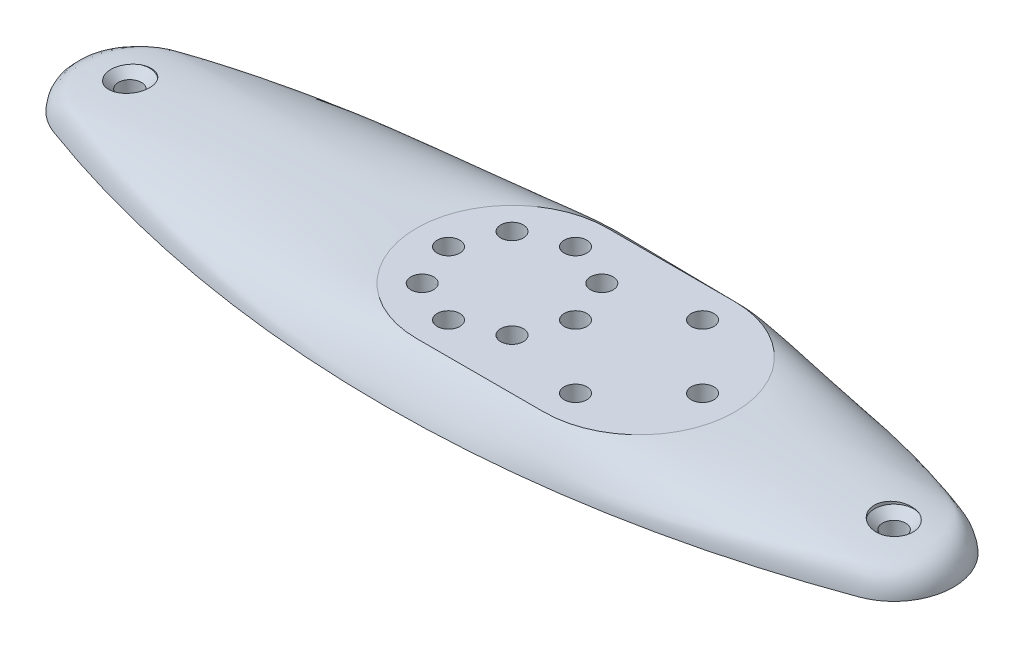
SolidWorks part; units mm, degrees
ref_plane "Front Plane" through (0, 0, 0) normal (0, 0, 1) x (1, 0, 0)
ref_plane "Top Plane" through (0, 0, 0) normal (0, 1, 0) x (1, 0, 0)
ref_plane "Right Plane" through (0, 0, 0) normal (1, 0, 0) x (0, 0, -1)
sketch "Sketch1" plane through (0, 0, 0) normal (0, 1, 0) x (1, 0, 0)
  line L0 (0, 19.05) -> (0, -19.05) construction
  line L1 (-66.04, 0) -> (66.04, 0) construction
  line L2 (19.05, 18.0083) -> (19.05, -18.0083) construction
  arc A0 (-60.214, 8.3453) -> (-60.214, -8.3453) centre (-57.15, 0) ccw
  arc A1 (60.214, 8.3453) -> (60.214, -8.3453) centre (57.15, 0) cw
  arc A2 (-60.214, 8.3453) -> (60.214, 8.3453) centre (0, -155.6544) cw
  arc A3 (-60.214, -8.3453) -> (60.214, -8.3453) centre (0, 155.6544) ccw
  point P8 (0, 19.05)
  dimension "D1" = 8.89
  dimension "D2" = 38.1
  dimension "D3" = 114.3
  dimension "D4" = 19.05
ref_plane "Plane1" through (0, 6.35, 0) normal (0, 1, 0) x (1, 0, 0)
sketch "Sketch2" plane through (0, 6.35, 0) normal (0, 1, 0) x (1, 0, 0)
  line L0 (0, 14.2875) -> (0, -14.2875) construction
  line L1 (-14.2875, 0) -> (33.3375, 0) construction
  line L2 (0, 14.2875) -> (19.05, 14.2875)
  line L3 (19.05, -14.2875) -> (0, -14.2875)
  arc A0 (0, 14.2875) -> (0, -14.2875) centre (0, 0) ccw
  arc A1 (19.05, 14.2875) -> (19.05, -14.2875) centre (19.05, 0) cw
  dimension "D1" = 28.575
  dimension "D2" = 19.05
sketch "Sketch3" plane through (0, 0, 0) normal (1, 0, 0) x (0, 0, -1)
  line L0 (17.4927, 6.35) -> (-17.4927, 6.35) construction
  line L1 (14.2875, 6.35) -> (-14.2875, 6.35) construction
  line L2 (19.05, 0) -> (-19.05, 0) construction
  arc A0 (-19.05, 0) -> (-14.2875, 6.35) centre (-7.0176, -4.0634) cw
  arc A1 (14.2875, 6.35) -> (19.05, 0) centre (7.0176, -4.0634) cw
  dimension "D1" = 12.7
sketch "Sketch4" plane through (0, 0, 0) normal (0, 0, 1) x (1, 0, 0)
  line L3 (-60.214, 0) -> (-66.04, 0) construction
  line L4 (-66.04, 0) -> (-66.04, -2.54) construction
  line L5 (-66.04, -2.54) -> (66.04, -2.54) construction
  line L6 (66.04, -2.54) -> (66.04, 0) construction
  line L7 (-66.04, 0) -> (66.04, 0) construction
  line L8 (60.214, 0) -> (-60.214, 0) construction
  arc A0 (-62.5937, 3.81) -> (-14.2875, 6.35) centre (-11.7964, -501.6439) cw
  arc A1 (33.3375, 6.35) -> (62.6461, 3.81) centre (4.1494, -500.8108) cw
  arc A2 (-62.5937, 3.81) -> (-66.04, 0) centre (-62.2108, 0) ccw
  arc A3 (62.6461, 3.81) -> (66.04, 0) centre (62.2045, 0) cw
  dimension "D1" = 508
  dimension "D2" = 3.81
  dimension "D3" = 3.81
  dimension "D4" = 2.54
ref_plane "Plane2" through (19.05, 0, 0) normal (1, 0, 0) x (0, 0, -1)
sketch "Sketch8" plane through (19.05, 0, 0) normal (1, 0, 0) x (0, 0, -1)
  arc A0 (14.2875, 6.35) -> (18.0083, 0) centre (5.6605, -2.9701) cw
  arc A1 (-14.2875, 6.35) -> (-18.0083, 0) centre (-5.6605, -2.9701) ccw
  arc A2 (19.05, 0) -> (14.2875, 6.35) centre (7.0176, -4.0634) ccw construction
loft "Loft1" add profiles "Sketch2", "Sketch1"
sketch "Sketch5" plane through (0, 0, 0) normal (0, -1, 0) x (-1, 0, 0)
  line L0 (-9.5, 0) -> (0, 0) construction
  line L1 (0, 0) -> (0, 9.5) construction
  line L2 (0, 0) -> (9.5, 0) construction
  line L3 (0, 0) -> (0, -9.5) construction
  line L4 (-9.5, 0) -> (-19, 0) construction
  line L5 (66.04, 0) -> (-66.04, 0) construction
  line L6 (-19, 0) -> (-19, -9.5) construction
  line L7 (-19, 0) -> (-28.5, 0) construction
  line L8 (-19, 0) -> (-19, 9.5) construction
  line L9 (6.7175, -6.7175) -> (0, 0) construction
  line L10 (0, 0) -> (6.7175, 6.7175) construction
  line L11 (-6.7175, 6.7175) -> (0, 0) construction
  line L12 (0, 0) -> (-6.7175, -6.7175) construction
  circle A0 centre (-9.5, 0) radius 1.75
  circle A1 centre (0, 9.5) radius 1.75
  circle A2 centre (9.5, 0) radius 1.75
  circle A3 centre (0, -9.5) radius 1.75
  circle A4 centre (-57.15, 0) radius 1.75
  circle A5 centre (57.15, 0) radius 1.75
  circle A6 centre (-28.5, 0) radius 1.75
  circle A7 centre (-19, 9.5) radius 1.75
  circle A8 centre (-19, -9.5) radius 1.75
  circle A9 centre (6.7175, 6.7175) radius 1.75
  circle A10 centre (-6.7175, 6.7175) radius 1.75
  circle A11 centre (-6.7175, -6.7175) radius 1.75
  circle A12 centre (6.7175, -6.7175) radius 1.75
  dimension "D2" = 3.5
  dimension "D5" = 3.5
  dimension "D6" = 45
  dimension "D1" = 19
  dimension "D3" = 57.15
  dimension "D4" = 57.15
extrude "Cut-Extrude1" cut sketch "Sketch5" against normal through all
ref_plane "Plane3" through (58.9, 0, 0) normal (-1, 0, 0) x (0, 0, 1)
ref_plane "Plane5" through (-58.9, 0, 0) normal (1, 0, 0) x (0, 0, -1)
sketch "Sketch16" plane through (58.9, 0, 0) normal (-1, 0, 0) x (0, 0, 1)
  line L0 (0, 4.2303) -> (-2, 4.2303)
  line L1 (0, 4.2303) -> (0, 0) construction
  spline S0 degree 3 poles (-1.75, 4.3985) (-1.75, 4.3742) (-1.7387, 4.3626) (-1.6939, 4.3403) (-1.6602, 4.3297) (-1.5293, 4.3004) (-1.3988, 4.2835) (-1.1566, 4.2635) (-1.0668, 4.2576) (-0.8756, 4.2476) (-0.7748, 4.2435) (-0.563, 4.2369) (-0.4511, 4.2344) (-0.2265, 4.2311) (-0.1127, 4.2303) (0.2335, 4.2303) (0.4614, 4.2336) (0.7809, 4.2437) (0.8815, 4.2479) (1.0713, 4.2579) (1.1612, 4.2638) (1.3226, 4.2773) (1.3947, 4.2847) (1.5214, 4.3014) (1.5758, 4.3107) (1.7055, 4.3401) (1.7505, 4.3628) (1.7495, 4.4107) (1.7036, 4.4363) (1.5726, 4.4734) (1.5178, 4.4857) (1.391, 4.5089) (1.3188, 4.5199) (1.0755, 4.5509) (0.8828, 4.568) (0.5626, 4.5857) (0.4532, 4.5901) (0.2288, 4.5962) (0.1126, 4.5977) (-0.117, 4.5977) (-0.2307, 4.5961) (-0.4559, 4.59) (-0.5674, 4.5854) (-0.8836, 4.5678) (-1.0787, 4.5505) (-1.4001, 4.5095) (-1.5299, 4.4855) (-1.6605, 4.4485) (-1.6942, 4.4357) (-1.7387, 4.4108) (-1.75, 4.3985) (-1.75, 4.3742) (-1.7387, 4.3626) knots -0.03125 -0.03125 0 0 0.03125 0.03125 0.0625 0.0625 0.125 0.125 0.15625 0.15625 0.1875 0.1875 0.21875 0.21875 0.25 0.25 0.3125 0.3125 0.34375 0.34375 0.375 0.375 0.40625 0.40625 0.4375 0.4375 0.5 0.5 0.5625 0.5625 0.59375 0.59375 0.625 0.625 0.6875 0.6875 0.71875 0.71875 0.75 0.75 0.78125 0.78125 0.8125 0.8125 0.875 0.875 0.9375 0.9375 0.96875 0.96875 1 1 1.03125 1.03125 1.0625 only from (-1.75, 4.3863) to (-1.75, 4.3863) construction
  dimension "D1" = 2
sketch "Sketch18" plane through (-58.9, 0, 0) normal (1, 0, 0) x (0, 0, -1)
  line L0 (0, 4.1676) -> (-2, 4.1676)
  line L1 (0, 4.2303) -> (0, 0) construction
  spline S0 degree 3 poles (0.1158, 4.4815) (-0.1158, 4.4815) (-0.2302, 4.4802) (-0.4561, 4.4751) (-0.5672, 4.4713) (-0.8832, 4.4566) (-1.0784, 4.4421) (-1.3196, 4.4164) (-1.3931, 4.407) (-1.5201, 4.3873) (-1.5735, 4.3772) (-1.6607, 4.3563) (-1.6944, 4.3455) (-1.7387, 4.3244) (-1.75, 4.314) (-1.7501, 4.283) (-1.7053, 4.2638) (-1.5732, 4.2381) (-1.5195, 4.2302) (-1.3929, 4.2157) (-1.3191, 4.209) (-1.1572, 4.1972) (-1.0691, 4.1921) (-0.8785, 4.1832) (-0.7758, 4.1795) (-0.4592, 4.1706) (-0.2283, 4.1676) (0.1144, 4.1676) (0.23, 4.1684) (0.4556, 4.1713) (0.5648, 4.1736) (0.7763, 4.1795) (0.8792, 4.1832) (1.0692, 4.1921) (1.1574, 4.1972) (1.4011, 4.215) (1.5297, 4.2296) (1.6616, 4.2553) (1.6944, 4.2643) (1.7387, 4.2833) (1.7501, 4.2934) (1.7499, 4.314) (1.7387, 4.3244) (1.6943, 4.3456) (1.6606, 4.3563) (1.53, 4.3876) (1.3999, 4.4078) (1.0782, 4.4422) (0.8833, 4.4566) (0.5666, 4.4713) (0.455, 4.4751) (0.23, 4.4802) (0.1158, 4.4815) (-0.1158, 4.4815) (-0.2302, 4.4802) knots -0.03125 -0.03125 0 0 0.03125 0.03125 0.0625 0.0625 0.125 0.125 0.15625 0.15625 0.1875 0.1875 0.21875 0.21875 0.25 0.25 0.3125 0.3125 0.34375 0.34375 0.375 0.375 0.40625 0.40625 0.4375 0.4375 0.5 0.5 0.53125 0.53125 0.5625 0.5625 0.59375 0.59375 0.625 0.625 0.6875 0.6875 0.71875 0.71875 0.75 0.75 0.78125 0.78125 0.8125 0.8125 0.875 0.875 0.9375 0.9375 0.96875 0.96875 1 1 1.03125 1.03125 1.0625 only from (0, 4.4815) to (0, 4.4815) construction
  dimension "D1" = 2
ref_plane "Plane4" through (0, 4.2303, 0) normal (0, 1, 0) x (1, 0, 0)
ref_plane "Plane6" through (0, 4.1676, 0) normal (0, 1, 0) x (1, 0, 0)
sketch "Sketch17" plane through (0, 4.2303, 0) normal (0, 1, 0) x (1, 0, 0)
  circle A0 centre (57.15, 0) radius 2.95
  circle A1 centre (57.15, 0) radius 1.75 construction
  dimension "D1" = 1.2
extrude "Cut-Extrude7" cut sketch "Sketch17" along normal blind 3
sketch "Sketch19" plane through (0, 4.1676, 0) normal (0, 1, 0) x (1, 0, 0)
  circle A0 centre (-57.15, 0) radius 2.95
  circle A1 centre (-57.15, 0) radius 1.75 construction
  dimension "D1" = 1.2
extrude "Cut-Extrude8" cut sketch "Sketch19" along normal blind 3
chamfer "Chamfer2" distance 1.2 angle 45 2 edges at (57.15, 4.2303, 1.75) (-57.15, 4.1676, 1.75)
shell "Shell1" thickness 2
sketch "Sketch9" [suppressed] plane through (0, 0, 0) normal (0, -1, 0) x (1, 0, 0)
  line L0 (0, 0) -> (0, -19.05) construction
  line L1 (-15.5628, 2.9175) -> (-16.2809, 2.1993)
  line L2 (-16.2804, -2.2035) -> (-15.5632, -2.9226)
  line L3 (-9.5, 0) -> (0, -9.525) construction
  line L4 (-9.5, 0) -> (0, 9.5) construction
  line L5 (-50.8, 4.8963) -> (-50.8, 4.4444)
  line L6 (-47.625, 1.2694) -> (-36.195, 1.2694)
  line L7 (-47.625, -1.2706) -> (-36.195, -1.2706)
  line L8 (-50.8, -4.4456) -> (-50.8, -4.8963)
  line L9 (-33.02, 4.4444) -> (-33.02, 7.8527)
  line L10 (19, 9.5) -> (28.5, 0) construction
  line L11 (-30.48, 9.57) -> (-30.48, 4.4444)
  line L12 (-33.02, -4.4456) -> (-33.02, -7.8527)
  line L13 (-30.48, -4.4456) -> (-30.48, -9.57)
  line L14 (-27.305, 1.2694) -> (-18.526, 1.2694)
  line L15 (-27.305, -1.2706) -> (-18.5284, -1.2706)
  line L16 (28.5, 0) -> (19, -9.5) construction
  line L17 (32.2112, 5.2691) -> (35.2352, 2.2451)
  line L18 (35.2352, -2.2451) -> (32.2112, -5.2691)
  line L19 (50.8, 4.1676) -> (50.8, -4.1676)
  arc A0 (-60.214, -8.3453) -> (60.214, -8.3453) centre (0, 155.6544) ccw construction
  arc A2 (-15.5632, -2.9226) -> (-20.8346, -13.7093) centre (-20.0592, -7.4068) cw
  arc A3 (-15.5628, 2.9175) -> (-20.828, 13.7101) centre (-20.0529, 7.4076) ccw
  arc A5 (-27.8227, -12.7025) -> (-20.8346, -13.7093) centre (0, 155.6544) ccw
  circle A6 centre (-57.15, 0) radius 1.75 construction
  arc A7 (-58.8133, -4.5303) -> (58.8133, -4.5303) centre (0, 155.6544) ccw
  arc A8 (-58.8133, 4.5303) -> (-58.8133, -4.5303) centre (-57.15, 0) ccw
  arc A9 (58.8133, 4.5303) -> (-58.8133, 4.5303) centre (0, -155.6544) ccw
  arc A10 (-48.5279, -7.9402) -> (-36.8812, -10.9527) centre (0, 155.6544) ccw
  arc A11 (-50.8, -4.8963) -> (-48.5279, -7.9402) centre (-47.625, -4.8963) ccw
  arc A12 (-20.828, 13.7101) -> (-27.8227, 12.7025) centre (0, -155.6544) ccw
  arc A13 (-50.8, 4.8963) -> (-48.5279, 7.9402) centre (-47.625, 4.8963) cw
  arc A14 (-36.8812, 10.9527) -> (-48.5279, 7.9402) centre (0, -155.6544) ccw
  arc A15 (-18.526, 1.2694) -> (-16.2809, 2.1993) centre (-18.526, 4.4444) ccw
  arc A16 (-18.5284, -1.2706) -> (-16.2804, -2.2035) centre (-18.5284, -4.4456) cw
  arc A17 (-30.48, -9.57) -> (-27.8227, -12.7025) centre (-27.305, -9.57) ccw
  arc A18 (-33.02, -7.8527) -> (-36.8812, -10.9527) centre (-36.195, -7.8527) cw
  arc A19 (-30.48, -4.4456) -> (-27.305, -1.2706) centre (-27.305, -4.4456) cw
  arc A20 (-30.48, 4.4444) -> (-27.305, 1.2694) centre (-27.305, 4.4444) ccw
  arc A21 (-27.8227, 12.7025) -> (-30.48, 9.57) centre (-27.305, 9.57) ccw
  arc A22 (-33.02, 7.8527) -> (-36.8812, 10.9527) centre (-36.195, 7.8527) ccw
  arc A23 (-33.02, 4.4444) -> (-36.195, 1.2694) centre (-36.195, 4.4444) cw
  arc A24 (-33.02, -4.4456) -> (-36.195, -1.2706) centre (-36.195, -4.4456) ccw
  arc A25 (-47.625, -1.2706) -> (-50.8, -4.4456) centre (-47.625, -4.4456) ccw
  arc A26 (-47.625, 1.2694) -> (-50.8, 4.4444) centre (-47.625, 4.4444) cw
  arc A29 (35.1123, -10.6206) -> (48.5317, -7.2103) centre (0, 155.6544) ccw
  arc A30 (35.1123, 10.6206) -> (48.5317, 7.2103) centre (0, -155.6544) cw
  arc A31 (60.214, 8.3453) -> (-60.214, 8.3453) centre (0, -155.6544) ccw construction
  circle A32 centre (57.15, 0) radius 1.75 construction
  arc A33 (48.5317, -7.2103) -> (50.8, -4.1676) centre (47.625, -4.1676) ccw
  arc A34 (48.5317, 7.2103) -> (50.8, 4.1676) centre (47.625, 4.1676) cw
  arc A35 (35.2352, 2.2451) -> (35.2352, -2.2451) centre (32.9901, 0) cw
  arc A36 (32.2112, -5.2691) -> (35.1123, -10.6206) centre (34.4563, -7.5141) ccw
  arc A37 (32.2112, 5.2691) -> (35.1123, 10.6206) centre (34.4563, 7.5141) cw
  circle A38 centre (0, 9.5) radius 1.75 construction
  circle A39 centre (-9.5, 0) radius 1.75 construction
  circle A40 centre (19, 9.5) radius 1.75 construction
  circle A41 centre (28.5, 0) radius 1.75 construction
  circle A42 centre (19, -9.5) radius 1.75 construction
  point P47 (-17.2109, 1.2694)
  point P50 (-17.2109, -1.2706)
  point P53 (-30.48, -12.2417)
  point P58 (-30.48, -1.2706)
  point P61 (-30.48, 1.2694)
  point P66 (-33.02, 11.7607)
  point P69 (-33.02, 1.2694)
  point P74 (-50.8, -1.2706)
  point P104 (37.4803, 0)
  point P107 (25.049, -12.4313)
  point P110 (25.049, 12.4313)
  dimension "D3" = 6.35
  dimension "D5" = 3.175
  dimension "D9" = 3.175
  dimension "D12" = 4.7625
  dimension "D13" = 3.175
  dimension "D2" = 6.35
  dimension "D4" = 6.35
  dimension "D6" = 2.54
  dimension "D7" = 2.54
  dimension "D8" = 17.78
  dimension "D10" = 6.35
  dimension "D11" = 6.35
  dimension "D1" = 4.064
hole_wizard "CSK for M3 Flat Head Machine Screw1" positions "Sketch11" profile "Sketch10" countersink size "M3" standard "ANSI Metric"
sketch "Sketch11" plane through (0, 0, 0) normal (0, -1, 0) x (-1, 0, 0)
  circle A3 centre (-6.7175, -6.7175) radius 1.75 construction
  circle A4 centre (-6.7175, 6.7175) radius 1.75 construction
  circle A5 centre (6.7175, 6.7175) radius 1.75 construction
  circle A6 centre (6.7175, -6.7175) radius 1.75 construction
  point P0 (9.5, 0)
  point P3 (0, -9.5)
  point P6 (-9.5, 0)
  point P9 (-19, -9.5)
  point P12 (0, 9.5)
  point P15 (-19, 9.5)
  point P18 (-28.5, 0)
  point P21 (6.7175, -6.7175)
  point P23 (-6.7175, -6.7175)
  point P27 (6.7175, 6.7175)
  point P31 (-6.7175, 6.7175)
sketch "Sketch10" plane through (-9.5, 0, 0) normal (1, 0, 0) x (0, 0, -1)
  line L0 (0, 0) -> (0, 6.3584)
  line L1 (0, 6.3584) -> (1.7, 6.3584)
  line L2 (1.7, 6.3584) -> (1.7, 1.45)
  line L3 (1.7, 1.45) -> (3.15, 0)
  line L5 (3.15, 0) -> (0, 0)
  line L6 (-1.7, 1.45) -> (-3.15, 0) construction
  line L11 (0, -6.35) -> (0, 107.95) construction
  dimension "Thru Hole Dia." = 3.4
  dimension "Thru Hole Depth" = 6.3584
  dimension "Near C'Sink Dia." = 6.3
  dimension "Near C'Sink Angle" = 90
draft "Draft1" type of draft neutral plane draft angle 0.5 faces to draft 13 parameters "D1"=0.5
sketch "Sketch12" plane through (0, 0, 0) normal (0, -1, 0) x (1, 0, 0)
  line L0 (-31.5, 0) -> (-9.5, 0) construction
  circle A0 centre (-31.5, 0) radius 2.5 construction
  circle A1 centre (-18.8, 0) radius 2.5 construction
  circle A2 centre (-31.5, 0) radius 4
  circle A3 centre (-18.8, 0) radius 4
  dimension "D2" = 5
  dimension "D4" = 1.5
  dimension "D5" = 1.5
  dimension "D1" = 22
  dimension "D3" = 12.7
extrude "Boss-Extrude1" add sketch "Sketch12" against normal up to next draft 2
sketch "Sketch20" plane through (0, 0, 0) normal (0, -1, 0) x (1, 0, 0)
  line L0 (-64.0399, 0) -> (64.0399, 0)
  line L1 (0, 16.9193) -> (0, -16.9191)
  line L2 (19, 15.9354) -> (19, -15.9354)
  line L3 (-18.8, 4) -> (-18.8, 15.96)
  line L4 (-31.5, 4) -> (-31.5, 14.1249)
  line L5 (28.5, 14.6578) -> (28.5, -14.6577)
  line L6 (-31.5, -4) -> (-31.5, -14.1248)
  line L7 (-18.8, -4) -> (-18.8, -15.96)
  line L8 (-57.15, 7.3128) -> (-57.15, -7.3128)
  line L9 (57.15, -7.3107) -> (57.15, 7.3107)
  line L10 (42.5, 11.7288) -> (42.5, -11.7285)
  line L11 (-43.5, 11.4692) -> (-43.5, -11.4691)
  circle A0 centre (-18.8, 0) radius 4 construction
  circle A1 centre (-31.5, 0) radius 4 construction
  spline S0 degree 3 number of poles 146 (61.4164, -5.4023) -> (61.4164, -5.4023) construction
  dimension "D1" = 12
  dimension "D2" = 14
rib "Rib1" sketch "Sketch20" sketch "Sketch20" thickness 2 extrusion direction normal to sketch draft on yes draft angle 2 parameters "D1"=2, "D3"=2
sketch "Sketch14" plane through (0, 0, 0) normal (0, -1, 0) x (1, 0, 0)
  circle A0 centre (-31.5, 0) radius 2.5 construction
  circle A1 centre (-18.8, 0) radius 2.5 construction
  circle A2 centre (-31.5, 0) radius 2.5
  circle A3 centre (-18.8, 0) radius 2.5
extrude "Cut-Extrude5" cut sketch "Sketch14" against normal blind 4 draft 2
draft "Draft2" type of draft neutral plane draft angle 2 faces to draft 40 parameters "D1"=2
fillet "Fillet1" radius 1 155 edges at (-21.032, 4.2265, 3.4958) (-19.9343, 3.847, 8.7993) (-17.6612, 3.9743, 8.8051) (-11.2795, 4.35, 8.6487) (-33.72, 3.8008, 3.4858) (-32.608, 3.0927, 8.7604) (-30.3871, 3.2334, 8.7671) (-28.9103, 4.0071, -3.23) (-30.3871, 3.2334, -8.7671) (-16.2064, 4.3212, -3.2409) (-17.6612, 3.9743, -8.8051) (-59.7093, 2.0168, 2.8365) (-54.3377, 2.4919, -2.9872) (54.2553, 2.6097, 2.9847) (59.702, 2.0426, -2.8442) (41.4335, 1.9049, -1.0665) (43.5635, 1.8186, -1.0635) (43.6165, 3.3356, -5.5386) (43.5635, 1.8186, 1.0635) (41.4335, 1.9049, 1.0665) (41.3764, 3.5391, -5.4934) (-44.5573, 1.6411, 1.0573) (-42.4402, 1.7113, 1.0598) (-42.4402, 1.7113, -1.0598) (-42.4367, 1.813, -10.3847) (-44.5757, 2.1675, -8.9875) (-44.5573, 1.6411, -1.0573) (-15.0661, 4.3432, 1.8151) (-22.0134, 4.2269, -2.6223) (-27.7723, 4.0874, 1.8074) (-34.7037, 3.7938, -2.6103) (54.1216, 2.6299, -2.8783) (-54.2321, 2.5051, 2.9028) (59.9055, 2.0321, 2.6471) (-60.0611, 2.0003, -2.4732) (-1.076, 2.175, 1.076) (1.076, 2.175, 1.076) (9.5184, 4.35, 13.5638) (-10.5371, 4.35, -9.5002) (1.1245, 3.5651, -14.5167) (1.076, 2.175, -1.076) (-1.1265, 3.6238, -14.4395) (-1.076, 2.175, -1.076) (17.924, 2.175, 1.076) (20.076, 2.175, 1.076) (9.5184, 4.35, -13.5638) (20.1262, 3.6134, -14.0322) (20.076, 2.175, -1.076) (17.8758, 3.5575, -14.1749) (17.924, 2.175, -1.076)
fillet "Fillet3" [suppressed] radius 1
fillet "Fillet4" [suppressed] radius 0.5
